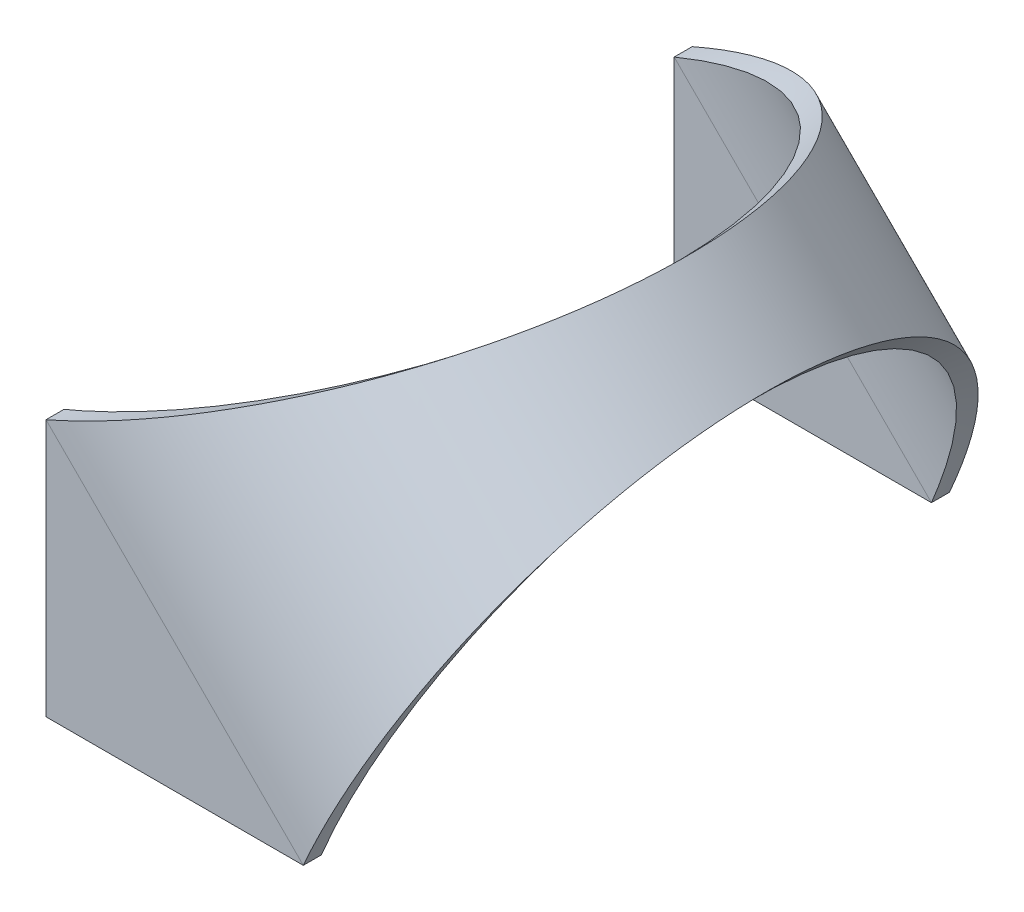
SolidWorks part; units mm, degrees
ref_plane "前视基准面" through (0, 0, 0) normal (0, 0, 1) x (1, 0, 0)
ref_plane "上视基准面" through (0, 0, 0) normal (0, 1, 0) x (1, 0, 0)
ref_plane "右视基准面" through (0, 0, 0) normal (1, 0, 0) x (0, 0, -1)
imported_body "基体零件-带补料的垂直三通管-1"
sheet metal parameters "钣金1" parameters "D1"=0.7366, "厚度"=1
bend "圆角折弯1" bend radius 16.963 bend angle 180 parameters "D5"=1
flatten bends "展开-折弯1"
sketch "尖角-草图1" plane through (0, 0, -16.963) normal (0, 0, 1) x (1, 0, 0)
  line L0 (33.1473, 18.8412) -> (18.8412, 33.1473) construction
  dimension "D1" = 0
process bends "加工-折弯1" parameters "D1"=0
sketch "平面-草图1" plane through (0, 0, -16.963) normal (0, 0, 1) x (1, 0, 0)
flat pattern "平板型式1"
sketch "折弯-线1" plane through (0, 0, 0) normal (0, 1, 0) x (-1, 0, 0)
bend of the flat pattern "展开-<圆角折弯1>1"
